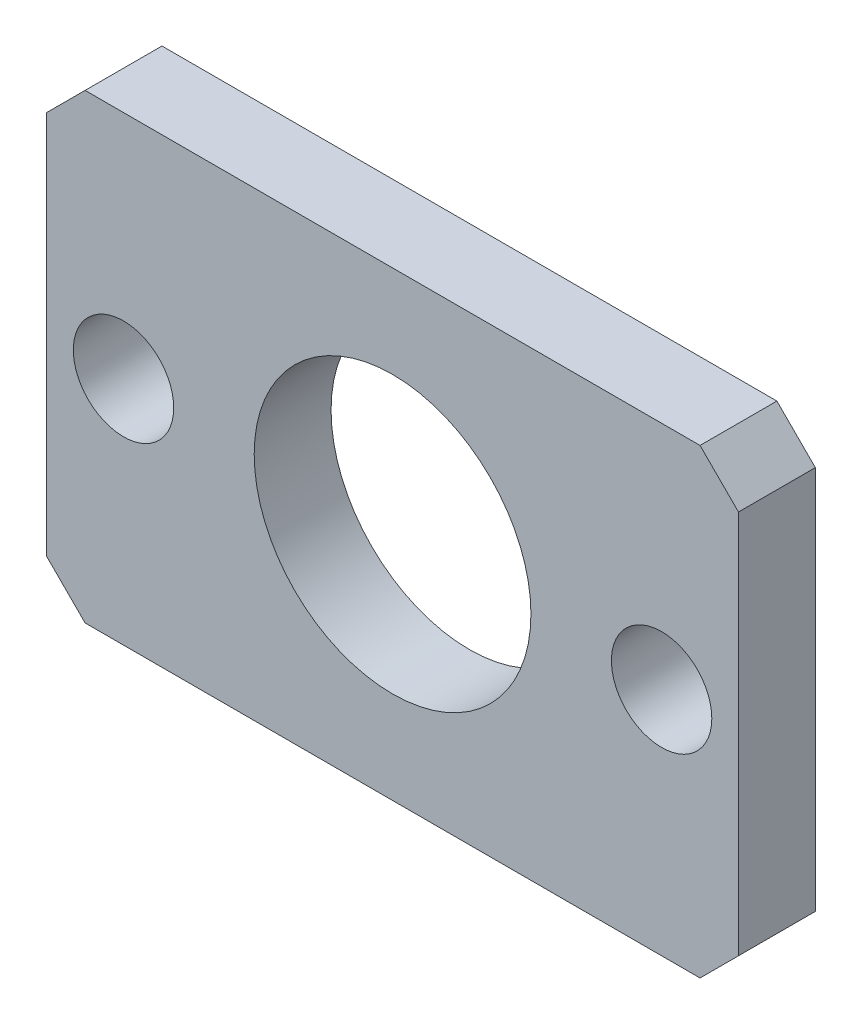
SolidWorks part; units mm, degrees
ref_plane "Face" through (0, 0, 0) normal (0, 0, 1) x (1, 0, 0)
ref_plane "Dessus" through (0, 0, 0) normal (0, 1, 0) x (1, 0, 0)
ref_plane "Droite" through (0, 0, 0) normal (1, 0, 0) x (0, 0, -1)
sketch "Esquisse1" plane through (0, 0, 0) normal (0, 0, 1) x (1, 0, 0)
  line L1 (-22.5, 15) -> (22.5, 15)
  line L2 (-22.5, 15) -> (-22.5, -15)
  line L3 (-22.5, -15) -> (22.5, -15)
  line L4 (22.5, 15) -> (22.5, -15)
  dimension "D1" = 45
  dimension "D2" = 30
  dimension "D3" = 22.5
  dimension "D4" = 15
extrude "Extrusion1" add sketch "Esquisse1" along normal blind 5
chamfer "Chanfrein1" distance 2.5 angle 45
sketch "Esquisse2" plane through (0, 0, 5) normal (0, 0, 1) x (1, 0, 0)
  circle A0 centre (0, 0) radius 9
  dimension "D1" = 18
extrude "Enlèv. mat.-Extru.1" cut sketch "Esquisse2" against normal through all
sketch "Esquisse3" plane through (0, 0, 5) normal (0, 0, 1) x (1, 0, 0)
  line L0 (22.6834, 0) -> (-33.1975, 0) construction
  circle A0 centre (17.5, 0) radius 3.265
  circle A1 centre (-17.5, 0) radius 3.265
  dimension "D1" = 6.53
  dimension "D2" = 35
  dimension "D3" = 17.5
extrude "Enlèv. mat.-Extru.2" cut sketch "Esquisse3" against normal through all
